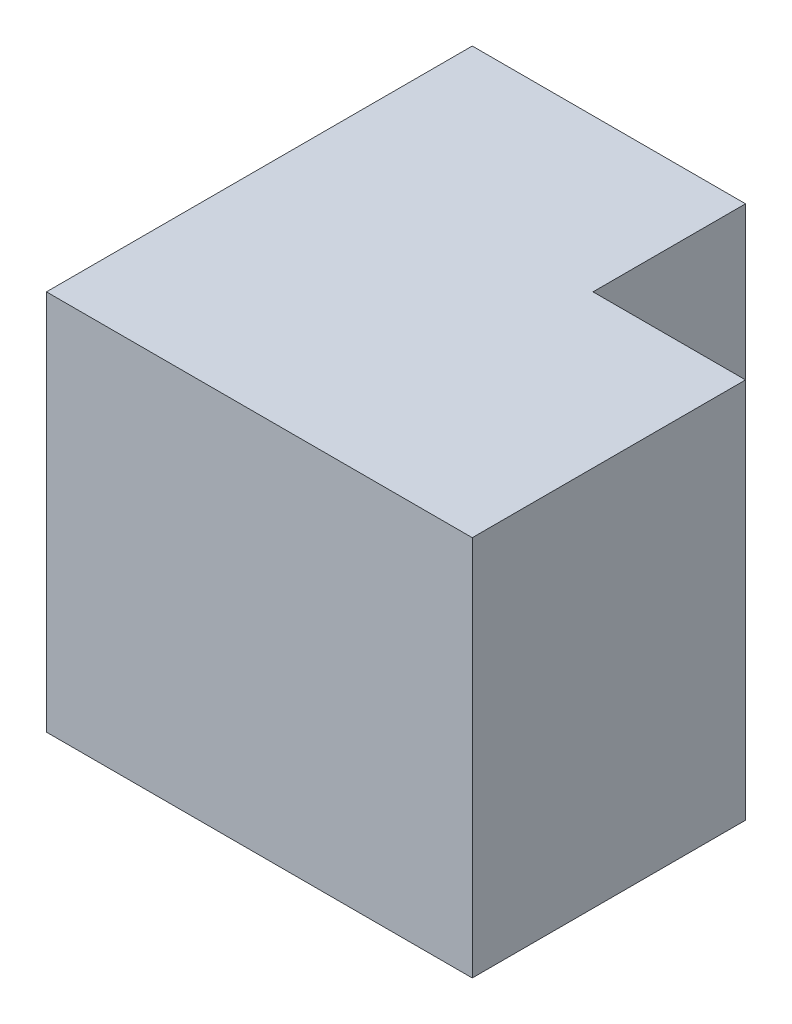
SolidWorks part; units mm, degrees
ref_plane "Plan de face" through (0, 0, 0) normal (0, 0, 1) x (1, 0, 0)
ref_plane "Plan de dessus" through (0, 0, 0) normal (0, 1, 0) x (1, 0, 0)
ref_plane "Plan de droite" through (0, 0, 0) normal (1, 0, 0) x (0, 0, -1)
sketch "Esquisse1" plane through (0, 0, 0) normal (0, 1, 0) x (1, 0, 0)
  line L1 (-33.5, 33.5) -> (33.5, 33.5)
  line L2 (-33.5, 33.5) -> (-33.5, -33.5)
  line L3 (-33.5, -33.5) -> (33.5, -33.5)
  line L4 (33.5, 33.5) -> (33.5, -33.5)
  line L5 (-33.5, 33.5) -> (33.5, -33.5) construction
  line L6 (-33.5, -33.5) -> (33.5, 33.5) construction
  line L7 (33.5, 33.5) -> (9.5, 33.5)
  line L8 (33.5, 33.5) -> (33.5, 9.5)
  line L9 (33.5, 9.5) -> (9.5, 9.5)
  line L10 (9.5, 33.5) -> (9.5, 9.5)
  point P0 (0, 0)
  dimension "D1" = 67
  dimension "D2" = 67
  dimension "D3" = 24
extrude "Boss.-Extru.1" add sketch "Esquisse1" along normal blind 60 contours L10 L1 L2 L3 L4 L9
